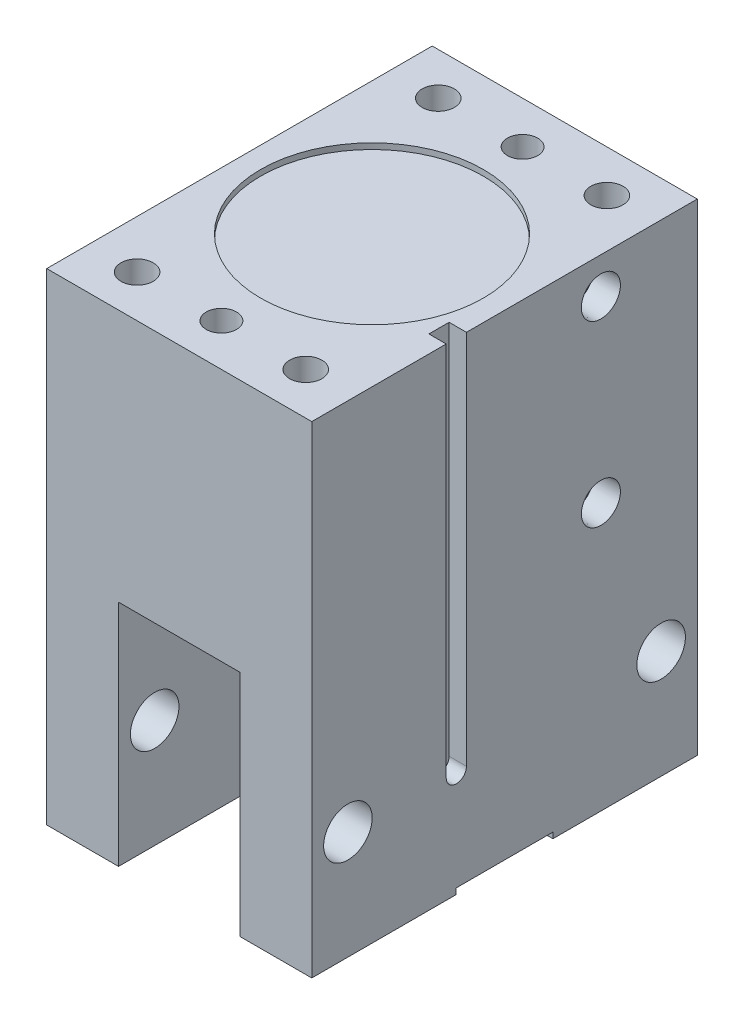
SolidWorks part; units mm, degrees
ref_plane "Front/Back" through (0, 0, 0) normal (0, 0, 1) x (1, 0, 0)
ref_plane "Top/Bottom" through (0, 0, 0) normal (0, 1, 0) x (1, 0, 0)
ref_plane "Right/Left" through (0, 0, 0) normal (1, 0, 0) x (0, 0, -1)
sketch "Sketch1" plane through (0, 0, 0) normal (0, 1, 0) x (1, 0, 0)
  line L0 (0, 0) -> (34.925, 0) construction
  line L1 (-34.925, 50.8) -> (34.925, 50.8)
  line L2 (-34.925, 50.8) -> (-34.925, -50.8)
  line L3 (-34.925, -50.8) -> (34.925, -50.8)
  line L4 (34.925, 50.8) -> (34.925, -50.8)
  line L5 (0, 0) -> (0, 50.8) construction
  dimension "D1" = 69.85
  dimension "D2" = 101.6
extrude "Extrude1" add sketch "Sketch1" along normal mid plane 127
hole_wizard "M10 X 1.5 (Mount Holes)" positions "Sketch3" profile "Sketch2" tap size "M10x1.5" standard "Ansi Metric"
sketch "Sketch3" plane through (0, 63.5, 0) normal (0, 1, 0) x (-1, 0, 0)
  line L0 (0, 0) -> (0, 56.7657) construction
  line L1 (0, 0) -> (40.0234, 0) construction
  point P0 (-22.225, -39.6875)
  point P1 (-22.225, 39.6875)
  point P2 (22.225, 39.6875)
  point P3 (22.225, -39.6875)
  dimension "D1" = 44.45
  dimension "D2" = 79.375
sketch "Sketch2" plane through (22.225, 63.5, -39.6875) normal (1, 0, 0) x (0, 0, 1)
  line L0 (0, 0) -> (0, 22.5537)
  line L1 (0, 22.5537) -> (4.25, 20)
  line L2 (4.25, 20) -> (4.25, 0)
  line L5 (4.25, 0) -> (0, 0)
  line L10 (0, 22.5537) -> (-4.25, 20) construction
  line L11 (0, -6.35) -> (0, 107.95) construction
  dimension "Tap Drill Dia." = 8.5
  dimension "Tap Drill Depth" = 20
  dimension "Drill Angle" = 118
sketch "Sketch4" plane through (0, 63.5, 0) normal (0, 1, 0) x (-1, 0, 0)
  line L0 (0, 0) -> (0, 54.61) construction
  line L1 (0, 0) -> (38.8737, 0) construction
  circle A0 centre (0, 39.6875) radius 4
  circle A1 centre (0, -39.6875) radius 4
  dimension "D1" = 8
  dimension "D2" = 79.375
extrude "(8MM Dowel Holes - Slip Fit)" cut sketch "Sketch4" against normal blind 10
sketch "Sketch5" plane through (0, 63.5, 0) normal (0, 1, 0) x (-1, 0, 0)
  circle A0 centre (0, 0) radius 29.3624
  dimension "D1" = 58.7248
extrude "Cut-Extrude2" cut sketch "Sketch5" against normal blind 1.524
hole_wizard "G1/8 Tapped Hole1" positions "Sketch8" profile "Sketch7" size "1/8" standard "Ansi Inch"
sketch "Sketch8" plane through (34.925, 0, 0) normal (1, 0, 0) x (0, 0, -1)
  line L0 (0, 0) -> (56.2585, 0) construction
  line L1 (0, 0) -> (0, 66.6035) construction
  line L2 (0, 61.976) -> (0, 63.5) construction
  line L3 (-50.8, 63.5) -> (50.8, 63.5) construction
  point P0 (25.4, 53.975)
  point P1 (25.4, 6.858)
  dimension "D1" = 47.117
  dimension "D2" = 9.525
  dimension "D3" = 25.4
sketch "Sketch7" plane through (34.925, 53.975, -25.4) normal (0, 1, 0) x (0, 0, -1)
  line L0 (0, 0) -> (0, 12.7)
  line L1 (4.2, 12.7) -> (0, 12.7)
  line L2 (-4.2, 12.7) -> (0, 12.7) construction
  line L3 (4.2, 12.7) -> (4.2, 6.924)
  line L4 (4.2, 6.924) -> (4.9362, 6.924)
  line L5 (4.9362, 6.924) -> (5.1435, 0)
  line L6 (-4.9362, 6.924) -> (-5.1435, 0) construction
  line L7 (5.1435, 0) -> (0, 0)
  line L8 (0, -6.35) -> (0, 107.95) construction
  line L11 (-4.2, 6.924) -> (-4.9362, 6.924) construction
  dimension "Tap Drill Dia." = 8.4
  dimension "Tap Drill Depth" = 12.7
  dimension "Thread Dia." = 10.287
  dimension "Thread Angle" = 3.43
  dimension "Thread Depth" = 6.924
  dimension "Drill Angle" = 180
sketch "Sketch9" plane through (22.225, 0, 0) normal (1, 0, 0) x (0, 0, -1)
  circle A0 centre (25.4, 53.975) radius 0.8001
  circle A1 centre (25.4, 53.975) radius 5.1435 construction
  circle A2 centre (25.4, 6.858) radius 0.8001
  circle A4 centre (25.4, 6.858) radius 5.1435 construction
  dimension "D1" = 1.6002
extrude "Cut-Extrude3" cut sketch "Sketch9" against normal blind 6.35
hole_wizard "M8 X 1.25 (Mount Holes)" positions "Sketch11" profile "Sketch10" tap size "M8x1.25" standard "Ansi Metric"
sketch "Sketch11" plane through (-34.925, 0, 0) normal (-1, 0, 0) x (0, 0, 1)
  line L0 (0, 0) -> (56.4909, 0) construction
  line L1 (0, 0) -> (0, 67.5334) construction
  line L2 (0, 61.976) -> (0, 63.5) construction
  line L3 (-50.8, 63.5) -> (50.8, 63.5) construction
  point P0 (-41.275, 33.02)
  point P1 (41.275, 33.02)
  point P2 (41.275, 7.62)
  point P3 (-41.275, 7.62)
  dimension "D1" = 82.55
  dimension "D2" = 30.48
  dimension "D3" = 25.4
sketch "Sketch10" plane through (-34.925, 33.02, -41.275) normal (0, 1, 0) x (0, 0, 1)
  line L0 (0, 0) -> (0, 18.0429)
  line L1 (0, 18.0429) -> (3.4, 16)
  line L2 (3.4, 16) -> (3.4, 0)
  line L5 (3.4, 0) -> (0, 0)
  line L10 (0, 18.0429) -> (-3.4, 16) construction
  line L11 (0, -6.35) -> (0, 107.95) construction
  dimension "Tap Drill Dia." = 6.8
  dimension "Tap Drill Depth" = 16
  dimension "Drill Angle" = 118
sketch "Sketch12" plane through (-34.925, 0, 0) normal (-1, 0, 0) x (0, 0, 1)
  line L0 (0, 0) -> (54.6312, 0) construction
  line L1 (0, 0) -> (0, 67.5334) construction
  line L2 (0, 61.976) -> (0, 63.5) construction
  circle A0 centre (-41.275, 20.32) radius 4
  circle A1 centre (41.275, 20.32) radius 4
  dimension "D1" = 8
  dimension "D2" = 12.7
extrude "(8MM Dowel Holes - Slip Fit )" cut sketch "Sketch12" against normal blind 6
sketch "Sketch13" plane through (34.925, 0, 0) normal (1, 0, 0) x (0, 0, -1)
  line L0 (0, 0) -> (60.443, 0) construction
  line L1 (0, 0) -> (0, 66.836) construction
  line L2 (0, 61.976) -> (0, 63.5) construction
  line L4 (-50.8, -63.5) -> (50.8, -63.5) construction
  circle A0 centre (41.275, -34.925) radius 6.4
  circle A1 centre (-41.275, -34.925) radius 6.4
  dimension "D1" = 12.8
  dimension "D2" = 28.575
  dimension "D3" = 82.55
extrude "Cut-Extrude5" cut sketch "Sketch13" against normal through all
sketch "Sketch14" plane through (34.925, 0, 0) normal (1, 0, 0) x (0, 0, -1)
  line L0 (0, 0) -> (0, 67.0685) construction
  line L1 (0, 61.976) -> (0, 63.5) construction
  line L2 (0, 0) -> (61.3729, 0) construction
  line L3 (-10.033, -35.56) -> (-10.033, 63.5)
  line L4 (-15.367, -35.56) -> (-15.367, 63.5)
  line L5 (-15.367, 63.5) -> (-10.033, 63.5)
  line L6 (-50.8, 63.5) -> (-50.8, -63.5) construction
  line L7 (-50.8, 63.5) -> (50.8, 63.5) construction
  arc A0 (-15.367, -35.56) -> (-10.033, -35.56) centre (-12.7, -35.56) ccw
  dimension "D2" = 2.667
  dimension "D1" = 38.1
  dimension "D3" = 99.06
extrude "Cut-Extrude6" cut sketch "Sketch14" against normal blind 4.572
sketch "Sketch15" plane through (0, 0, 50.8) normal (0, 0, 1) x (1, 0, 0)
  line L0 (0, 0) -> (49.0518, 0) construction
  line L1 (0, 0) -> (0, 66.836) construction
  line L2 (0, 53.5) -> (0, 63.5) construction
  line L3 (-34.925, -63.5) -> (34.925, -63.5) construction
  line L4 (-16.002, -63.5) -> (16.002, -63.5)
  line L5 (-16.002, -63.5) -> (-16.002, -3.175)
  line L6 (-16.002, -3.175) -> (16.002, -3.175)
  line L7 (16.002, -63.5) -> (16.002, -3.175)
  line L8 (-34.925, 63.5) -> (34.925, 63.5) construction
  dimension "D1" = 32.004
  dimension "D2" = 66.675
extrude "Cut-Extrude7" cut sketch "Sketch15" against normal through all
sketch "Sketch16" plane through (34.925, 0, 0) normal (1, 0, 0) x (0, 0, -1)
  line L0 (-50.8, -63.5) -> (50.8, -63.5) construction
  line L1 (-12.7635, -63.5) -> (12.7635, -63.5)
  line L2 (-12.7635, -63.5) -> (-12.7635, -61.976)
  line L3 (-12.7635, -61.976) -> (12.7635, -61.976)
  line L4 (12.7635, -63.5) -> (12.7635, -61.976)
  line L5 (0, 0) -> (0, 79.7875) construction
  line L6 (0, 61.976) -> (0, 63.5) construction
  dimension "D1" = 25.527
  dimension "D2" = 1.524
extrude "Cut-Extrude8" cut sketch "Sketch16" against normal through all
hole_wizard "M8x1.25 Tapped Hole1" positions "Sketch18" profile "Sketch17" tap size "M8x1.25" standard "Ansi Metric"
sketch "Sketch18" plane through (0, -61.976, 0) normal (0, -1, 0) x (1, 0, 0)
  line L0 (0, 0) -> (40.3108, 0) construction
  line L1 (0, 0) -> (0, 59.2088) construction
  point P0 (28.575, 0)
  point P1 (-28.575, 0)
  dimension "D1" = 57.15
sketch "Sketch17" plane through (28.575, -61.976, 0) normal (1, 0, 0) x (0, 0, -1)
  line L0 (0, 0) -> (0, 25.0429)
  line L1 (0, 25.0429) -> (3.4, 23)
  line L2 (3.4, 23) -> (3.4, 0)
  line L5 (3.4, 0) -> (0, 0)
  line L10 (0, 25.0429) -> (-3.4, 23) construction
  line L11 (0, -6.35) -> (0, 107.95) construction
  dimension "Tap Drill Dia." = 6.8
  dimension "Tap Drill Depth" = 23
  dimension "Drill Angle" = 118
